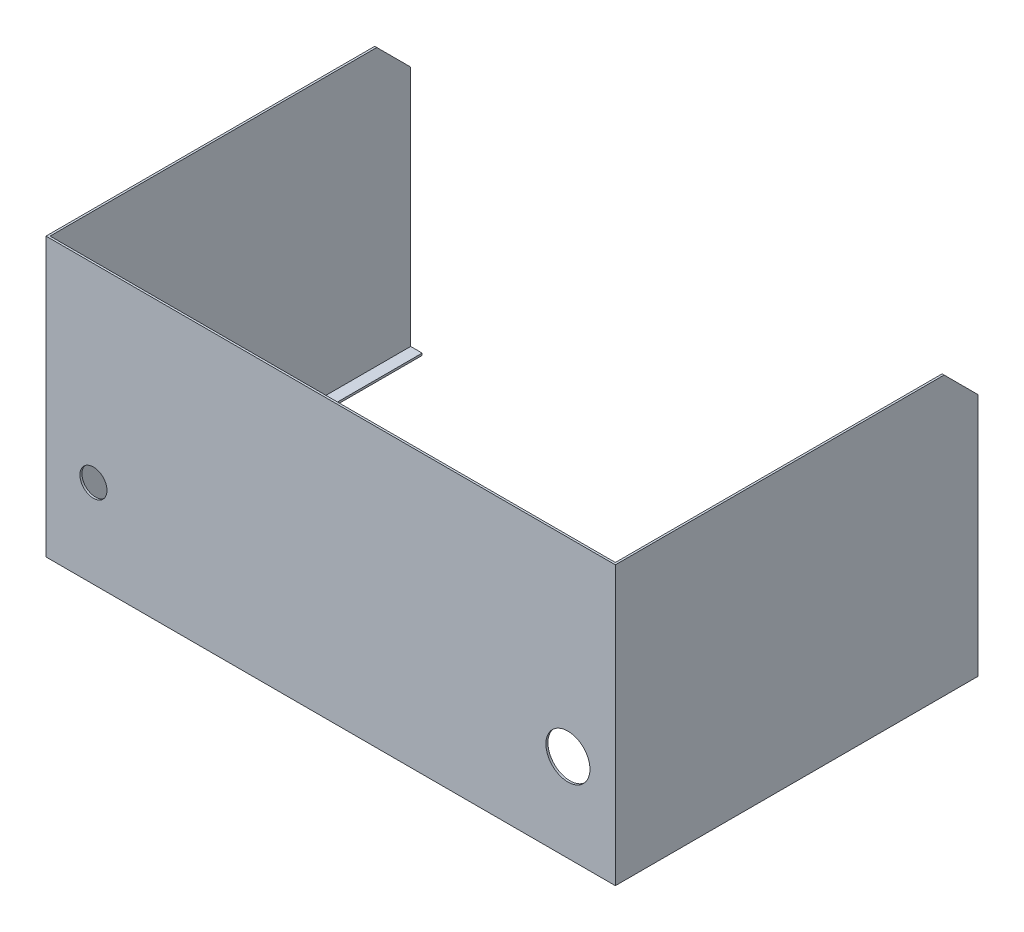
SolidWorks part; units mm, degrees
ref_plane "前视基准面" through (0, 0, 0) normal (0, 0, 1) x (1, 0, 0)
ref_plane "上视基准面" through (0, 0, 0) normal (0, 1, 0) x (1, 0, 0)
ref_plane "右视基准面" through (0, 0, 0) normal (1, 0, 0) x (0, 0, -1)
sketch "草图1" plane through (0, 0, 0) normal (0, 0, 1) x (1, 0, 0)
  line L1 (420, 205) -> (-420, 205)
  line L2 (420, 205) -> (420, -205)
  line L3 (420, -205) -> (-420, -205)
  line L4 (-420, 205) -> (-420, -205)
  line L5 (420, 205) -> (-420, -205) construction
  line L6 (420, -205) -> (-420, 205) construction
  circle A0 centre (-350, -75) radius 20
  circle A1 centre (350, -75) radius 32.5
  point P0 (0, 0)
  dimension "D3" = 70
  dimension "D1" = 840
  dimension "D2" = 410
  dimension "D4" = 130
  dimension "D5" = 70
  dimension "D6" = 130
extrude "凸台-拉伸1" add sketch "草图1" along normal blind 3
sketch "草图2" plane through (420, 0, 0) normal (1, 0, 0) x (0, 0, -1)
  line L0 (0, -205) -> (0, 205) construction
  line L1 (0, -205) -> (0, 205)
  line L2 (0, -205) -> (532, -205)
  line L3 (0, 205) -> (482, 205)
  line L4 (532, -205) -> (532, 155)
  line L5 (482, 205) -> (532, 155)
extrude "凸台-拉伸2" add sketch "草图2" against normal blind 3 separate body
sketch "草图3" plane through (-420, 0, 0) normal (-1, 0, 0) x (0, 0, 1)
  line L5 (-532, -205) -> (0, -205)
  line L6 (0, -205) -> (0, 205)
  line L7 (0, 205) -> (-482, 205)
  line L8 (-482, 205) -> (-532, 155)
  line L9 (-532, 155) -> (-532, -205)
  line L10 (-532, -205) -> (0, -205)
  line L11 (0, -205) -> (0, 205)
  line L12 (0, 205) -> (-482, 205)
  line L13 (-482, 205) -> (-532, 155)
  line L14 (-532, 155) -> (-532, -205)
  dimension "D1" = 0
extrude "凸台-拉伸3" add sketch "草图3" against normal blind 3
sketch "草图4" plane through (0, -205, 0) normal (0, -1, 0) x (1, 0, 0)
  line L0 (417, 0) -> (417, -532) construction
  line L1 (-417, 0) -> (420, 0) construction
  line L2 (-417, -532) -> (-417, 0) construction
  line L3 (417, 0) -> (417, -532)
  line L4 (-417, 0) -> (420, 0)
  line L5 (-417, -532) -> (-417, 0)
  line L6 (-417, -532) -> (-400, -532)
  line L7 (417, -532) -> (400, -532)
  line L8 (400, -532) -> (400, -17)
  line L9 (-400, -532) -> (-400, -17)
  line L10 (-400, -17) -> (400, -17)
extrude "凸台-拉伸4" add sketch "草图4" against normal blind 3 contours L9 L10 L8 L7 L3 L6 M4 M3
